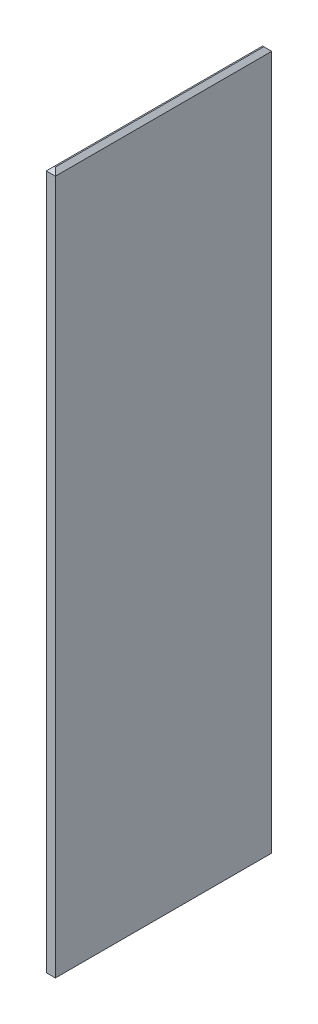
SolidWorks part; units mm, degrees
ref_plane "Front Plane" through (0, 0, 0) normal (1, 0, 0) x (0, 1, 0)
ref_plane "Top Plane" through (0, 0, 0) normal (0, 0, 1) x (0, 1, 0)
ref_plane "Right Plane" through (0, 0, 0) normal (0, 1, 0) x (-1, 0, 0)
sketch "Sketch1" plane through (0, 0, 0) normal (0, 1, 0) x (-1, 0, 0)
  line L1 (-63.5, 1500) -> (63.5, 1500)
  line L2 (-63.5, 1500) -> (-63.5, -1500)
  line L3 (-63.5, -1500) -> (63.5, -1500)
  line L4 (63.5, 1500) -> (63.5, -1500)
  line L5 (-63.5, 1500) -> (63.5, -1500) construction
  line L6 (-63.5, -1500) -> (63.5, 1500) construction
  point P0 (0, 0)
  dimension "D1" = 3000
  dimension "D2" = 127
extrude "Boss-Extrude1" add sketch "Sketch1" along normal blind 9739.6
ref_plane "Mating plane" through (0, 0, -1750) normal (0, 0, -1) x (0, 1, 0)
chamfer "Chamfer1" distance 55 angle 45 8 edges at (0, 0, 1500) (63.5, 0, 0) (0, 0, -1500) (-63.5, 0, 0) (0, 9739.6, -1500) (63.5, 9739.6, 0) (0, 9739.6, 1500) (-63.5, 9739.6, 0)
